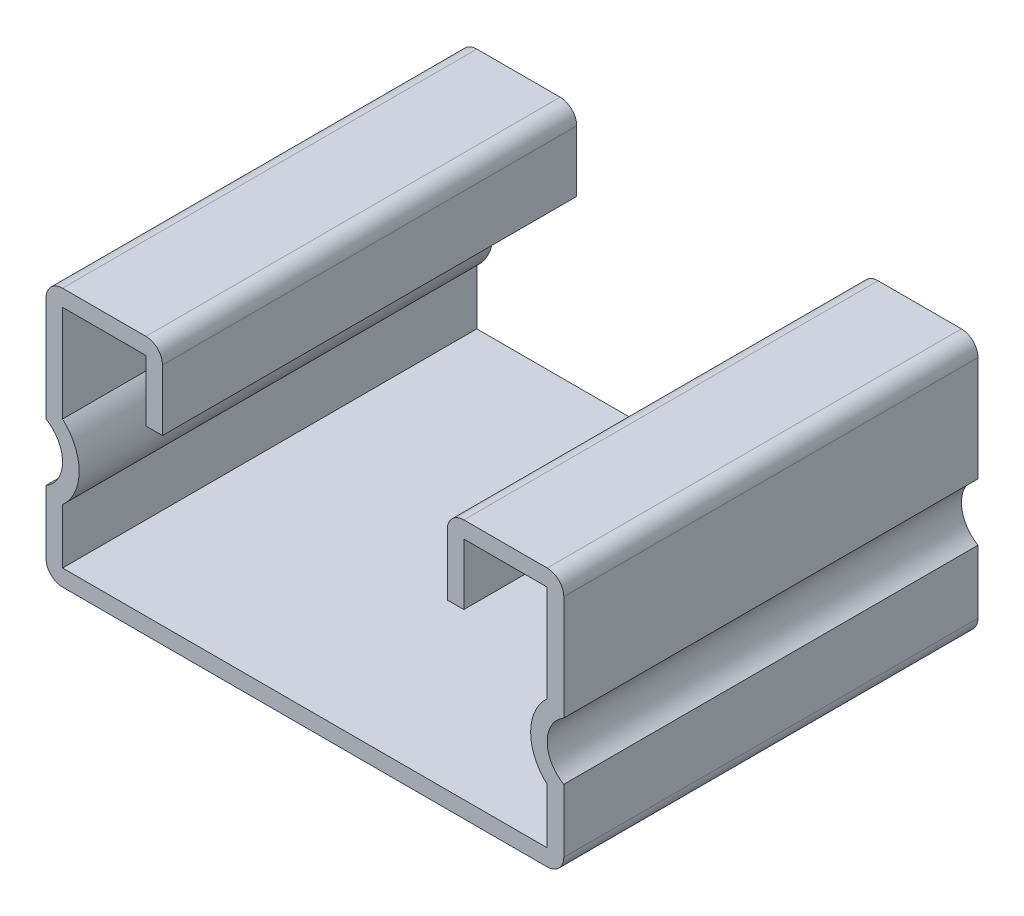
SolidWorks part; units mm, degrees
ref_plane "Plane1" through (0, 0, 0) normal (0, 0, 1) x (1, 0, 0)
ref_plane "Plane2" through (0, 0, 0) normal (0, 1, 0) x (1, 0, 0)
ref_plane "Plane3" through (0, 0, 0) normal (1, 0, 0) x (0, 0, -1)
sketch "Sketch1" plane through (0, 0, 0) normal (0, 0, 1) x (1, 0, 0)
  line L0 (-15.875, 8.2042) -> (-15.875, 1.7598)
  line L1 (-15.875, -1.7598) -> (-15.875, -5.6388)
  line L2 (-14.859, -6.6548) -> (14.859, -6.6548)
  line L3 (15.875, -5.6388) -> (15.875, -1.7598)
  line L4 (15.875, 1.7598) -> (15.875, 8.2042)
  line L5 (14.859, 9.2202) -> (9.7472, 9.2202)
  line L6 (8.7312, 8.2042) -> (8.7312, 4.4577)
  line L7 (-14.859, 9.2202) -> (-9.7472, 9.2202)
  line L8 (-8.7312, 8.2042) -> (-8.7312, 4.4577)
  line L9 (14.859, -3.9553) -> (14.859, 8.0137) construction
  line L10 (-14.859, 8.0137) -> (-14.859, -3.9553) construction
  line L11 (-9.7472, 8.2042) -> (-9.7472, 4.4577)
  line L12 (-14.859, 8.2042) -> (-9.7472, 8.2042)
  line L13 (-14.859, 8.2042) -> (-14.859, 2.2718)
  line L14 (-14.859, -2.2718) -> (-14.859, -5.6388)
  line L15 (-14.859, -5.6388) -> (14.859, -5.6388)
  line L16 (14.859, -5.6388) -> (14.859, -2.2718)
  line L17 (14.859, 2.2718) -> (14.859, 8.2042)
  line L18 (14.859, 8.2042) -> (9.7472, 8.2042)
  line L19 (9.7472, 8.2042) -> (9.7472, 4.4577)
  line L20 (-9.7472, 4.4577) -> (-8.7312, 4.4577)
  line L21 (8.7312, 4.4577) -> (9.7472, 4.4577)
  arc A0 (15.875, 1.7598) -> (15.875, -1.7598) centre (16.891, 0) ccw
  arc A1 (-15.875, -1.7598) -> (-15.875, 1.7598) centre (-16.891, 0) ccw
  arc A2 (-9.7472, 9.2202) -> (-8.7312, 8.2042) centre (-9.7472, 8.2042) cw
  arc A3 (-15.875, 8.2042) -> (-14.859, 9.2202) centre (-14.859, 8.2042) cw
  arc A4 (-14.859, -6.6548) -> (-15.875, -5.6388) centre (-14.859, -5.6388) cw
  arc A5 (15.875, -5.6388) -> (14.859, -6.6548) centre (14.859, -5.6388) cw
  arc A6 (14.859, 9.2202) -> (15.875, 8.2042) centre (14.859, 8.2042) cw
  arc A7 (8.7312, 8.2042) -> (9.7472, 9.2202) centre (9.7472, 8.2042) cw
  arc A8 (-14.859, -2.2718) -> (-14.859, 2.2718) centre (-16.891, 0) ccw
  arc A9 (14.859, 2.2718) -> (14.859, -2.2718) centre (16.891, 0) ccw
  dimension "D1" = 15.875
  dimension "D9" = 2.032
  dimension "D10" = 2.032
  dimension "Width" = 31.75
  dimension "base" = 6.6548
  dimension "ToeHt" = 9.2202
  dimension "D6" = 17.4625
  dimension "edge" = 7.1437
  dimension "Lip" = 4.7625
  dimension "gauge" = 1.016
extrude "Base-Extrude" add sketch "Sketch1" along normal mid plane 25.4
equation "\"D1@Sketch1\" = \"Width@Sketch1\" / 2"
equation "\"D6@Sketch1\" = \"Width@Sketch1\" - 2 * \"edge@Sketch1\""
equation "\"D10@Sketch1\" = 2 * \"gauge@Sketch1\""
equation "\"D9@Sketch1\" = \"D10@Sketch1\""
